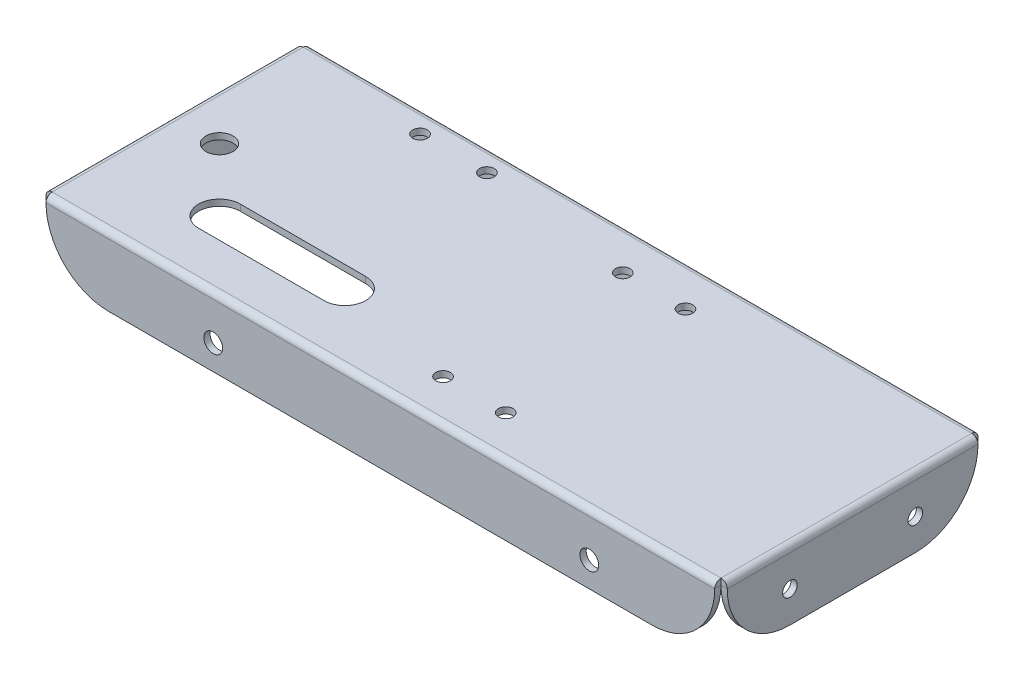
SolidWorks part; units mm, degrees
ref_plane "Front Plane" through (0, 0, 0) normal (0, 0, 1) x (1, 0, 0)
ref_plane "Top Plane" through (0, 0, 0) normal (0, 1, 0) x (1, 0, 0)
ref_plane "Right Plane" through (0, 0, 0) normal (1, 0, 0) x (0, 0, -1)
sketch "Sketch1" plane through (0, 0, 0) normal (0, 1, 0) x (1, 0, 0)
  line L0 (15, 75) -> (145, 75)
  line L1 (0, 0) -> (160, 0) construction
  line L2 (0, 0) -> (0, 60) construction
  line L3 (0, 60) -> (160, 60) construction
  line L4 (160, 0) -> (160, 60) construction
  line L5 (175, 45) -> (175, 15)
  line L6 (145, -15) -> (15, -15)
  line L7 (-15, 15) -> (-15, 45)
  line L8 (160, 30) -> (0, 30) construction
  line L9 (25, 20) -> (55, 20)
  line L10 (25, 10) -> (55, 10)
  arc A0 (175, 45) -> (160, 60) centre (160, 45) ccw
  arc A1 (160, 0) -> (175, 15) centre (160, 15) ccw
  arc A2 (-15, 15) -> (0, 0) centre (0, 15) ccw
  arc A3 (0, 60) -> (-15, 45) centre (0, 45) ccw
  arc A4 (15, 75) -> (0, 60) centre (15, 60) ccw
  arc A5 (160, 60) -> (145, 75) centre (145, 60) ccw
  arc A6 (145, -15) -> (160, 0) centre (145, 0) ccw
  arc A7 (0, 0) -> (15, -15) centre (15, 0) ccw
  circle A8 centre (40, 69) radius 2.25
  circle A9 centre (130, 69) radius 2.25
  circle A10 centre (130, -9) radius 2.25
  circle A11 centre (40, -9) radius 2.25
  circle A12 centre (167.5, 45) radius 1.75
  circle A13 centre (167.5, 15) radius 1.75
  circle A14 centre (-7.5, 15) radius 1.75
  circle A15 centre (-7.5, 45) radius 1.75
  circle A16 centre (10, 30) radius 3.25
  circle A17 centre (32, 56) radius 1.75
  circle A18 centre (48, 56) radius 1.75
  circle A19 centre (100, 51.5) radius 1.75
  circle A20 centre (85, 51.5) radius 1.75
  circle A21 centre (85, 8.5) radius 1.75
  circle A22 centre (100, 8.5) radius 1.75
  arc A23 (25, 20) -> (25, 10) centre (25, 15) ccw
  arc A24 (55, 10) -> (55, 20) centre (55, 15) ccw
  dimension "D1" = 30
  dimension "D4" = 4.5
  dimension "D6" = 30
  dimension "D5" = 30
  dimension "D8" = 40
  dimension "D9" = 40
  dimension "D11" = 9
  dimension "D12" = 9
  dimension "D13" = 9
  dimension "D14" = 3.5
  dimension "D15" = 15
  dimension "D17" = 7.5
  dimension "D18" = 7.5
  dimension "D19" = 15
  dimension "D20" = 7.5
  dimension "D21" = 7.5
  dimension "D22" = 15
  dimension "D23" = 10
  dimension "D24" = 6.5
  dimension "D25" = 3.5
  dimension "D26" = 3.5
  dimension "D27" = 4
  dimension "D28" = 4
  dimension "D29" = 8
  dimension "D30" = 8
  dimension "D31" = 3.5
  dimension "D32" = 60
  dimension "D33" = 60
  dimension "D34" = 15
  dimension "D35" = 15
  dimension "D36" = 43
  dimension "D37" = 43
  dimension "D38" = 21.5
  dimension "D39" = 21.5
  dimension "D40" = 5
  dimension "D2" = 160
  dimension "D3" = 60
  dimension "D7" = 30
  dimension "D10" = 9
  dimension "D16" = 15
  dimension "D41" = 15
  dimension "D43" = 15
  dimension "D44" = 15
sheet metal parameters "Sheet-Metal1" thickness 1.5 parameters "D1"=1
base flange "Base-Flange1" sketch "Sketch1" thickness 1.5 reverse thickness direction yes parameters "D1"=1
sketch "Sketch3" plane through (0, 1.5, 0) normal (0, 1, 0) x (1, 0, 0)
  line L0 (6.7957, 60) -> (152.7942, 60)
  line L1 (6.7957, 0) -> (152.7942, 0)
  line L2 (160, 6.9314) -> (160, 56.7596)
  line L3 (0, 9.3921) -> (0, 55.5292)
sketched bend "Sketched Bend4" parameters "D1"=0.001
bend "SketchBend10" bend radius 0.001 bend angle 90 parameters "D5"=1
bend "SketchBend11" bend radius 0.001 bend angle 90 parameters "D5"=2
bend "SketchBend12" bend radius 0.001 bend angle 90 parameters "D5"=3
bend "SketchBend13" bend radius 0.001 bend angle 90 parameters "D5"=4
flat pattern "Flat-Pattern1"
sketch "Bend-Lines1" plane through (0, 0, 0) normal (0, 1, 0) x (-1, 0, 0)
bend of the flat pattern "Flatten-<SketchBend10>1"
bend of the flat pattern "Flatten-<SketchBend11>1"
bend of the flat pattern "Flatten-<SketchBend12>1"
bend of the flat pattern "Flatten-<SketchBend13>1"
